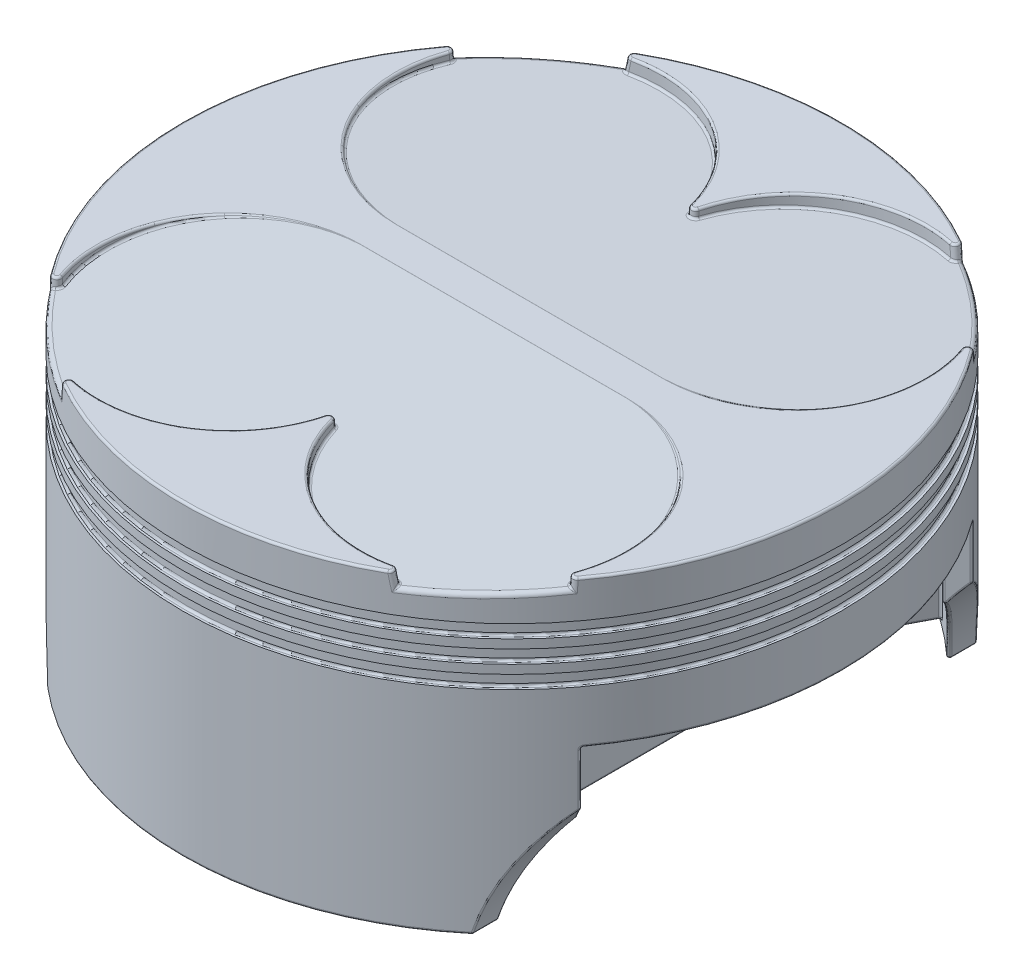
SolidWorks part; units mm, degrees
ref_plane "Front Plane" through (0, 0, 0) normal (0, 0, 1) x (1, 0, 0)
ref_plane "Top Plane" through (0, 0, 0) normal (0, 1, 0) x (1, 0, 0)
ref_plane "Right Plane" through (0, 0, 0) normal (1, 0, 0) x (0, 0, -1)
sketch "Sketch1" plane through (0, 0, 0) normal (0, 1, 0) x (1, 0, 0)
  circle A0 centre (0, 0) radius 75
  dimension "D1" = 150
extrude "Boss-Extrude1" add sketch "Sketch1" against normal blind 70
sketch "Sketch2" plane through (0, 0, 0) normal (1, 0, 0) x (0, 0, -1)
  line L0 (-75, 0) -> (-75, -70) construction
  line L1 (-76, -8.5) -> (-74, -8.5)
  line L2 (-76, -8.5) -> (-76, -11.5)
  line L3 (-76, -11.5) -> (-74, -11.5)
  line L4 (-74, -8.5) -> (-74, -11.5)
  line L5 (-76, -8.5) -> (-74, -11.5) construction
  line L6 (-76, -11.5) -> (-74, -8.5) construction
  line L8 (75, 0) -> (-75, 0) construction
  point P0 (-75, -10)
  dimension "D1" = 2
  dimension "D2" = 3
  dimension "D3" = 10
revolve "Cut-Revolve1" cut sketch "Sketch2" angle 360 about axis through (0, -70, 0) along (0, 1, 0)
pattern_linear "LPattern1" count 3 spacing 5 along (0, -1, 0) of "Cut-Revolve1"
shell "Shell1" thickness 10
sketch "Sketch3" plane through (0, -70, 0) normal (0, -1, 0) x (1, 0, 0)
  circle A2 centre (0, 0) radius 70
  circle A3 centre (0, 0) radius 70
  dimension "D1" = 5
extrude "Cut-Extrude1" cut sketch "Sketch3" against normal up to surface (38.5 mm away)
sketch "Sketch4" plane through (0, -70, 0) normal (0, -1, 0) x (1, 0, 0)
  line L0 (0, 0) -> (0, 75) construction
  line L1 (0, 0) -> (-70, 0) construction
  line L2 (-56.27, 41.6376) -> (-60.2893, 44.6117)
  line L3 (56.27, 41.6376) -> (60.2893, 44.6117)
  line L4 (56.27, -41.6376) -> (60.2893, -44.6117)
  line L5 (-56.27, -41.6376) -> (-60.2893, -44.6117)
  circle A0 centre (0, 0) radius 70 construction
  circle A1 centre (0, 0) radius 75 construction
  arc A2 (56.27, 41.6376) -> (-56.27, 41.6376) centre (0, 0) ccw
  arc A3 (60.2893, 44.6117) -> (-60.2893, 44.6117) centre (0, 0) ccw
  arc A4 (60.2893, -44.6117) -> (-60.2893, -44.6117) centre (0, 0) cw
  arc A5 (56.27, -41.6376) -> (-56.27, -41.6376) centre (0, 0) cw
  dimension "D1" = 107
extrude "Cut-Extrude2" cut sketch "Sketch4" against normal offset from surface (36.5 mm away) 2 flip side to cut
sketch "Sketch5" plane through (0, 0, 0) normal (0, 0, 1) x (1, 0, 0)
  line L3 (48.2893, -70) -> (60.2893, -70)
  line L4 (60.2893, -70) -> (60.2893, -45.5)
  line L5 (0, 0) -> (0, -70) construction
  line L6 (-60.2893, -70) -> (-60.2893, -45.5)
  line L7 (-48.2893, -70) -> (-60.2893, -70)
  line L8 (60.2893, -33.5) -> (60.2893, -70) construction
  line L9 (-60.2893, -70) -> (60.2893, -70) construction
  line L11 (60.2893, -33.5) -> (75, -33.5) construction
  arc A0 (48.2893, -70) -> (60.2893, -45.5) centre (102.1396, -81.1869) cw
  arc A1 (-48.2893, -70) -> (-60.2893, -45.5) centre (-102.1396, -81.1869) ccw
  dimension "D1" = 55
  dimension "D2" = 12
  dimension "D3" = 12
extrude "Cut-Extrude3" cut sketch "Sketch5" against normal through all both and the other way through all
ref_plane "Plane1" through (0, -68, 0) normal (0, -1, 0) x (-1, 0, 0)
sketch "Sketch6" plane through (0, -68, 0) normal (0, -1, 0) x (-1, 0, 0)
  line L0 (0, 0) -> (0, 75) construction
  line L1 (-17, -24.5) -> (-17, 24.5)
  line L2 (-39.5, -24.5) -> (-39.5, 24.5)
  line L3 (-39.5, -24.5) -> (-17, -24.5)
  line L4 (39.5, -24.5) -> (39.5, 24.5)
  line L5 (-39.5, 24.5) -> (-17, 24.5)
  line L6 (-39.5, -24.5) -> (39.5, 24.5) construction
  line L7 (39.5, -24.5) -> (-39.5, 24.5) construction
  line L8 (17, -24.5) -> (17, 24.5)
  line L9 (17, 24.5) -> (39.5, 24.5)
  line L10 (17, -24.5) -> (39.5, -24.5)
  arc A1 (48.2893, 57.3859) -> (-48.2893, 57.3859) centre (0, 0) ccw construction
  dimension "D1" = 17
  dimension "D2" = 49
  dimension "D3" = 22.5
extrude "Boss-Extrude2" add sketch "Sketch6" against normal up to surface (58 mm away)
sketch "Sketch8" plane through (0, -68, 0) normal (0, -1, 0) x (-1, 0, 0)
  line L0 (-22, 24.5) -> (-39.5, 57.7906)
  line L1 (-17, 24.5) -> (-39.5, 24.5) construction
  line L3 (0, 0) -> (0, 75) construction
  line L4 (0, 0) -> (-75, 0) construction
  line L5 (22, 24.5) -> (39.5, 57.7906)
  line L6 (22, -24.5) -> (39.5, -57.7906)
  line L7 (-22, -24.5) -> (-39.5, -57.7906)
  arc A0 (48.2893, 50.6769) -> (-48.2893, 50.6769) centre (0, 0) ccw construction
  arc A1 (48.2893, 57.3859) -> (-48.2893, 57.3859) centre (0, 0) ccw construction
  arc A2 (-60.2893, 44.6117) -> (-60.2893, -44.6117) centre (0, 0) ccw construction
  dimension "D1" = 5
rib "Rib1" sketch "Sketch8" sketch "Sketch8" thickness 5 extrusion direction normal to sketch draft on no parameters "D1"=5
sketch "Sketch9" plane through (0, -68, 0) normal (0, -1, 0) x (-1, 0, 0)
  line L0 (-30.75, 41.1453) -> (30.75, 41.1453)
  line L1 (-22, 24.5) -> (-39.5, 57.7906) construction
  line L2 (22, 24.5) -> (39.5, 57.7906) construction
  line L3 (-30.75, -41.1453) -> (30.75, -41.1453)
  line L4 (-22, -24.5) -> (-39.5, -57.7906) construction
  line L5 (22, -24.5) -> (39.5, -57.7906) construction
rib "Rib2" sketch "Sketch9" sketch "Sketch9" thickness 5 extrusion direction normal to sketch draft on no parameters "D1"=5
sketch "Sketch12" plane through (0, -31.5, 0) normal (0, -1, 0) x (1, 0, 0)
  line L0 (-39.5, 19.5) -> (-59.1249, 24.5)
  line L1 (-39.5, 24.5) -> (-39.5, -24.5) construction
  line L2 (-24.8244, 24.5) -> (-39.5, 24.5) construction
  line L3 (39.5, 19.5) -> (59.1249, 24.5)
  line L4 (39.5, -24.5) -> (39.5, 24.5) construction
  line L5 (0, 0) -> (-64, 0) construction
  line L6 (39.5, -19.5) -> (59.1249, -24.5)
  line L7 (-39.5, -19.5) -> (-59.1249, -24.5)
  arc A0 (-38.7292, 50.9514) -> (-38.7292, -50.9514) centre (0, 0) ccw construction
  arc A1 (38.7292, -50.9514) -> (38.7292, 50.9514) centre (0, 0) ccw construction
  dimension "D1" = 5
rib "Rib3" sketch "Sketch12" sketch "Sketch12" thickness 5 extrusion direction normal to sketch draft on no parameters "D1"=5
sketch "Sketch13" plane through (0, 0, 0) normal (1, 0, 0) x (0, 0, -1)
  line L0 (0, 0) -> (0, -68) construction
  line L1 (24.5, -68) -> (-24.5, -68) construction
  line L3 (-42.5, -73) -> (42.5, -73)
  line L4 (-42.5, -73) -> (-42.5, -63)
  line L5 (-42.5, -63) -> (42.5, -63)
  line L6 (42.5, -73) -> (42.5, -63)
  line L7 (-42.5, -73) -> (42.5, -63) construction
  line L8 (-42.5, -63) -> (42.5, -73) construction
  dimension "D1" = 85
  dimension "D2" = 10
extrude "Cut-Extrude4" cut sketch "Sketch13" against normal through all both and the other way through all
sketch "Sketch16" plane through (0, 0, 0) normal (1, 0, 0) x (0, 0, -1)
  line L9 (-43.6453, -10) -> (-53.8412, -10) construction
  circle A0 centre (0, -33.9) radius 13.9
  dimension "D1" = 27.8
  dimension "D2" = 10
extrude "Cut-Extrude6" cut sketch "Sketch16" against normal up to surface and the other way up to surface
sketch "Sketch14" plane through (0, 0, 0) normal (0, 1, 0) x (1, 0, 0)
  line L1 (-74.8933, -4) -> (74.8933, -4)
  line L2 (-74.8933, -4) -> (-74.8933, 4)
  line L3 (-74.8933, 4) -> (74.8933, 4)
  line L4 (74.8933, -4) -> (74.8933, 4)
  line L5 (-74.8933, -4) -> (74.8933, 4) construction
  line L6 (-74.8933, 4) -> (74.8933, -4) construction
  circle A0 centre (0, 0) radius 75 construction
  point P0 (0, 0)
  dimension "D1" = 8
ref_plane "Plane2" through (0, 0.2091, 0.011) normal (0, 0.9986, 0.0523) x (1, 0, 0)
sketch "Sketch15" plane through (0, 0.2091, 0.011) normal (0, 0.9986, 0.0523) x (1, 0, 0)
  line L0 (0, 0) -> (0, -74.8972) construction
  line L1 (-74.8933, -3.9945) -> (74.8933, -3.9945) construction
  line L2 (-30, -3.9945) -> (30, -3.9945)
  arc A0 (0, -33.9945) -> (30, -3.9945) centre (30, -33.9945) ccw
  arc A1 (-30, -3.9945) -> (0, -33.9945) centre (-30, -33.9945) ccw
  ellipse E0 centre (0, 0) end of major axis (75, 0) minor radius 74.8972 construction
  dimension "D1" = 60
extrude "Cut-Extrude5" cut sketch "Sketch15" along normal through all
fillet "Fillet1" radius 1 7 edges at (-49.7052, -2.7338, 56.164) (49.7052, -2.7338, 56.164) (0, -0.785, 34)
fillet "Fillet2" radius 0.5 13 edges at (59.0785, -2.3127, 45.4491) (58.2059, -2.134, 44.7193) (-37.942, -3.2993, 64.1804) (-37.3185, -3.1036, 63.2209) (37.942, -3.2993, 64.1804) (37.3594, -3.1046, 63.2396) (14.4309, -2.9122, 59.5675) (0, -1.9265, 40.7598) (-59.0785, -2.3127, 45.4491) (-58.2222, -2.1367, 44.7715) (54.5435, -0.6672, 16.7309) (-14.4309, -2.9122, 59.5675) (-54.5435, -0.6672, 16.7309)
fillet "Fillet3" radius 0.5 6 edges at (0, -18.5, -74) (0, -21.5, -74) (0, -13.5, -74) (0, -16.5, -74) (0, -8.5, -74) (0, -11.5, -74)
fillet "Fillet4" radius 0.5 206 edges at (-58.1985, -48.1085, 43.0646) (0, -70, -70) (0, -70, 75) (-39.5, -10, 0) (-39.5, -20.75, 22.0799) (-50.3959, -62.5429, -55.545) (-51.0054, -60.931, -47.9421) (-53.0512, -56.381, 53.0148) (-48.2893, -70, -54.0314) (-48.2893, -70, 54.0314) (-64, -31.5, 0) (-64, -10, 0) (-58.1985, -48.1085, -43.0646) (-49.7716, -31.5, 19.5371) (-49.7716, -10, 19.5371) (-48.8044, -10, 24.4504) (-39.5, -31.5, 19.5) (-48.8044, -31.5, 24.4504) (-39.5, -20.75, 16.9201) (39.5, -10, 23.2899) (39.5, -20.75, 16.9201) (39.5, -31.5, 19.5) (39.5, -20.75, 22.0799) (49.8996, -10, 40.0753) (49.8996, -31.5, 40.0753) (49.7716, -10, 19.5371) (49.7716, -31.5, 19.5371) (48.8044, -10, 24.4504) (48.8044, -31.5, 24.4504) (-17, -10, 0) (-17, -36.5, 24.5) (-18.0878, -10, 24.5) (-39.5, -36.5, 24.5) (-39.5, -10, 23.2899) (-39.5, -36.5, -24.5) (-32.1622, -10, -24.5) (-17, -36.5, -24.5) (39.5, -10, 0) (39.5, -20.75, -22.0799) (39.5, -31.5, -19.5) (39.5, -20.75, -16.9201) (17, -10, 0) (17, -36.5, -24.5) (18.0878, -10, -24.5) (64, -10, 0) (39.5, -36.5, -24.5) (39.5, -10, -23.2899) (64, -31.5, 0) (39.5, -36.5, 24.5) (32.1622, -10, 24.5) (17, -36.5, 24.5) (49.7716, -31.5, -19.5371) (49.7716, -10, -19.5371) (48.8044, -31.5, -24.4504) (48.8044, -10, -24.4504) (32.1622, -10, -24.5) (24.8244, -36.5, -24.5) (-49.8996, -31.5, -40.0753) (-49.8996, -10, -40.0753) (-39.5, -10, -23.2899) (36.0003, -31.5, -56.5059) (-48.8044, -10, -24.4504) (-39.5, -20.75, -22.0799) (-48.8044, -31.5, -24.4504) (-49.7716, -10, -19.5371) (-39.5, -31.5, -19.5) (-49.7716, -31.5, -19.5371) (-39.5, -20.75, -16.9201) (0, -63, 38.6453) (26.6114, -36.5, -38.6453) (-26.6114, -36.5, -38.6453) (37.9215, -68, 49.4149) (34.2865, -65.5, 42.5) (-37.9215, -68, 49.4149) (-37.9215, -68, -49.4149) (-34.2865, -65.5, -42.5) (37.9215, -68, -49.4149) (34.2865, -65.5, -42.5) (-34.2865, -65.5, 42.5) (-22.8935, -63, 31.5726) (0, -63, -38.6453) (22.8935, -63, -31.5726) (-29.5554, -63, -33.5) (0, -63, 42.5) (29.5554, -63, 33.5) (29.5554, -63, -33.5) (32.1622, -63, -24.5) (39.5, -63, 0) (32.1622, -63, 24.5) (17, -63, 0) (18.0878, -63, -24.5) (-22.8935, -63, -31.5726) (-18.0878, -63, -24.5) (-17, -63, 0) (-18.0878, -63, 24.5) (22.8935, -63, 31.5726) (18.0878, -63, 24.5) (0, -63, -42.5) (-29.5554, -63, 33.5) (-32.1622, -63, 24.5) (-39.5, -63, 0) (-32.1622, -63, -24.5) (-17, -33.9, -13.9) (17, -33.9, 13.9) (-39.5, -33.9, 13.9) (39.5, -33.9, -13.9) (22.8935, -10, -31.5726) (34.5995, -20.75, -53.8412) (37.4011, -49.75, -59.1706) (39.5043, -68, -57.7876) (31.7768, -10, -37.7257) (38.7292, -20.75, -50.9514) (40.1429, -31.5, -53.6407) (41.5565, -49.75, -56.3299) (49.8996, -10, -40.0753) (49.8996, -31.5, -40.0753) (-18.0878, -10, -24.5) (-24.8244, -36.5, -24.5) (0, -31.5, -64) (0, -31.5, -70) (-36.0003, -31.5, -56.5059) (0, -10, -64) (70, -31.5, 0) (-22.8935, -10, -31.5726) (-34.5995, -20.75, -53.8412) (-37.4011, -49.75, -59.1706) (-39.5043, -68, -57.7876) (-40.1429, -31.5, -53.6407) (-41.5565, -49.75, -56.3299) (-31.7768, -10, -37.7257) (-38.7292, -20.75, -50.9514) (70, -33.5, 0) (-70, -33.5, 0) (-32.1622, -10, 24.5) (-24.8244, -36.5, 24.5) (-49.8996, -10, 40.0753) (-22.8935, -10, 31.5726) (-70, -31.5, 0) (-37.4011, -49.75, 59.1706) (-49.8996, -31.5, 40.0753) (-36.0003, -31.5, 56.5059) (-34.5995, -20.75, 53.8412) (-39.5043, -68, 57.7876) (-31.7768, -10, 37.7257) (-38.7292, -20.75, 50.9514) (-40.1429, -31.5, 53.6407) (-41.5565, -49.75, 56.3299) (-75, -33.5, 0) (75, -33.5, 0) (-58.2796, -33.5, 43.1247) (-58.2796, -33.5, -43.1247) (58.2796, -33.5, -43.1247) (58.2796, -33.5, 43.1247) (56.27, -42.1696, -41.6376) (60.2893, -39.5, -44.6117) (-60.2893, -39.5, -44.6117) (-56.27, -42.1696, -41.6376) (-56.27, -42.1696, 41.6376) (-60.2893, -39.5, 44.6117) (60.2893, -39.5, 44.6117) (56.27, -42.1696, 41.6376) (18.0878, -10, 24.5) (24.8244, -36.5, 24.5) (0, -10, 64) (22.8935, -10, 31.5726) (0, -31.5, 70) (37.4011, -49.75, 59.1706) (0, -31.5, 64) (36.0003, -31.5, 56.5059) (34.5995, -20.75, 53.8412) (39.5043, -68, 57.7876) (40.1429, -31.5, 53.6407) (41.5565, -49.75, 56.3299) (31.7768, -10, 37.7257) (38.7292, -20.75, 50.9514) (-31.9197, -10, -48.7432) (-33.3204, -68, -51.4079) (-29.2398, -39, -43.6453) (33.3204, -68, -51.4079) (31.9197, -10, -48.7432) (58.1985, -48.1085, -43.0646) (29.2398, -39, -43.6453) (0, -10, -43.6453) (0, -68, -43.6453) (0, -70, 70) (0, -10, -38.6453) (0, -70, -75) (51.257, -60.307, 54.7514) (48.2893, -70, 54.0314) (52.1469, -58.258, -53.9046) (48.2893, -70, -54.0314) (58.1985, -48.1085, 43.0646) (31.9197, -10, 48.7432) (33.3204, -68, 51.4079) (29.2398, -39, 43.6453) (26.6114, -36.5, 38.6453) (-33.3204, -68, 51.4079) (-31.9197, -10, 48.7432) (0, -10, 38.6453) (-26.6114, -36.5, 38.6453) (0, -10, 43.6453) (-29.2398, -39, 43.6453) (0, -68, 43.6453)
mirror "Mirror1" about plane through (0, 0, 0) normal (0, 0, 1) of "Fillet2", "Fillet1", "Cut-Extrude5"
fillet "Fillet5" radius 0.5 28 edges at (37.3629, 0, -63.9892) (14.2345, 0, -59.5997) (0, 0, -40.8608) (-14.2345, 0, -59.5997) (-37.4039, 0, -64.0971) (-37.3629, 0, 63.9892) (-14.2345, 0, 59.5997) (0, 0, 40.8608) (14.2345, 0, 59.5997) (37.4039, 0, 64.0971) (58.7129, 0, 45.1914) (59.3652, 0, 27.8938) (41.9628, 0, 6.4918) (0, 0, 4) (-41.9628, 0, 6.4918) (-59.3652, 0, 27.8938) (-58.8323, 0, 45.2551) (-75, 0, 0) (-58.7129, 0, -45.1914) (-59.3652, 0, -27.8938) (-41.9628, 0, -6.4918) (0, 0, -4) (41.9628, 0, -6.4918) (59.3652, 0, -27.8938) (58.8323, 0, -45.2551) (0, 0, -75) (0, 0, 75) (75, 0, 0)
